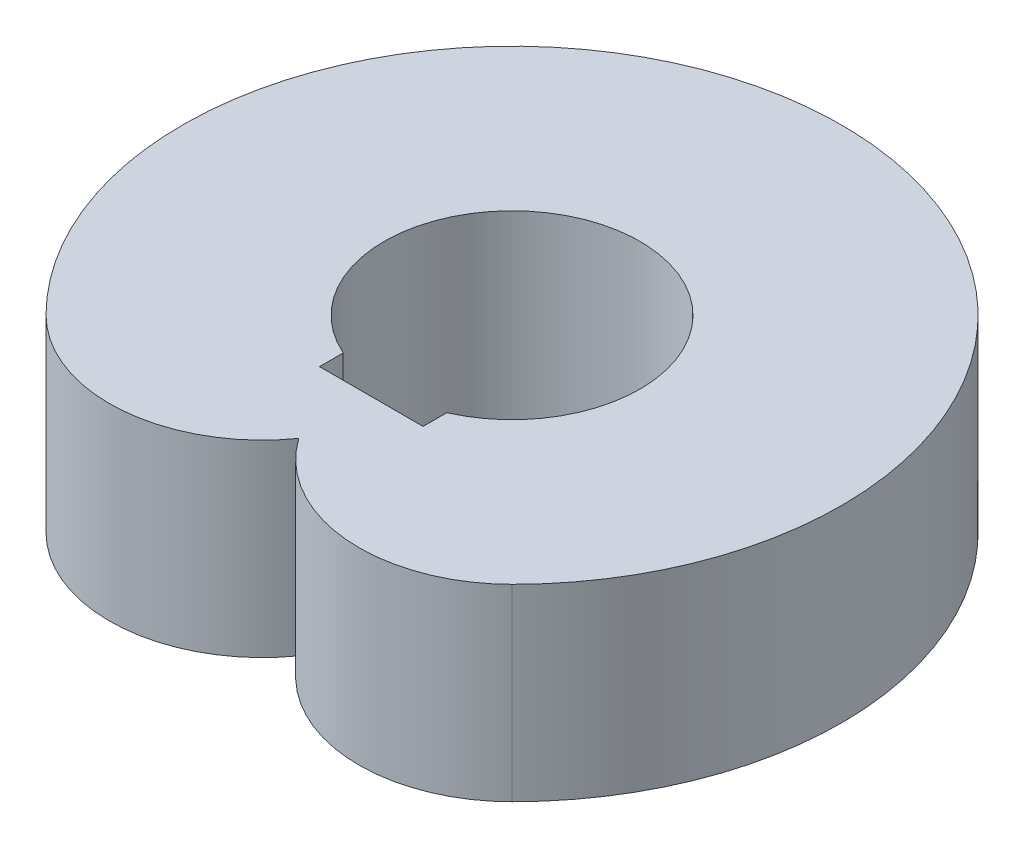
SolidWorks part; units mm, degrees
ref_plane "前视基准面" through (0, 0, 0) normal (0, 0, 1) x (1, 0, 0)
ref_plane "上视基准面" through (0, 0, 0) normal (0, 1, 0) x (1, 0, 0)
ref_plane "右视基准面" through (0, 0, 0) normal (1, 0, 0) x (0, 0, -1)
sketch "草图1" plane through (0, 0, 0) normal (0, 1, 0) x (1, 0, 0)
  line L0 (0, 0) -> (0, 825) construction
  line L1 (0, 0) -> (-494.9747, -494.9747) construction
  line L2 (0, 0) -> (494.9747, -494.9747) construction
  line L3 (0, 375) -> (229.8097, 145.1903) construction
  line L4 (0, 375) -> (-229.8097, 145.1903) construction
  line L7 (-110, -299) -> (110, -299)
  line L9 (-110, -248.5814) -> (-110, -299)
  line L10 (110, -248.5814) -> (110, -299)
  circle A0 centre (0, 0) radius 375 construction
  circle A1 centre (0, 375) radius 325 construction
  arc A2 (494.9747, -494.9747) -> (-494.9747, -494.9747) centre (0, 0) ccw
  arc A4 (-494.9747, -494.9747) -> (0, -453.0812) centre (-265.165, -265.165) ccw
  arc A5 (0, -453.0812) -> (494.9747, -494.9747) centre (265.165, -265.165) ccw
  arc A7 (110, -248.5814) -> (-110, -248.5814) centre (0, 0) ccw
  point P19 (0, -299)
  dimension "D1" = 750
  dimension "D2" = 650
  dimension "D4" = 135
  dimension "D3" = 700
  dimension "D8" = 325
  dimension "D5" = 135
  dimension "D6" = 135
  dimension "D7" = 135
  dimension "D9" = 220
  dimension "D10" = 299
extrude "凸台-拉伸1" add sketch "草图1" along normal blind 400
